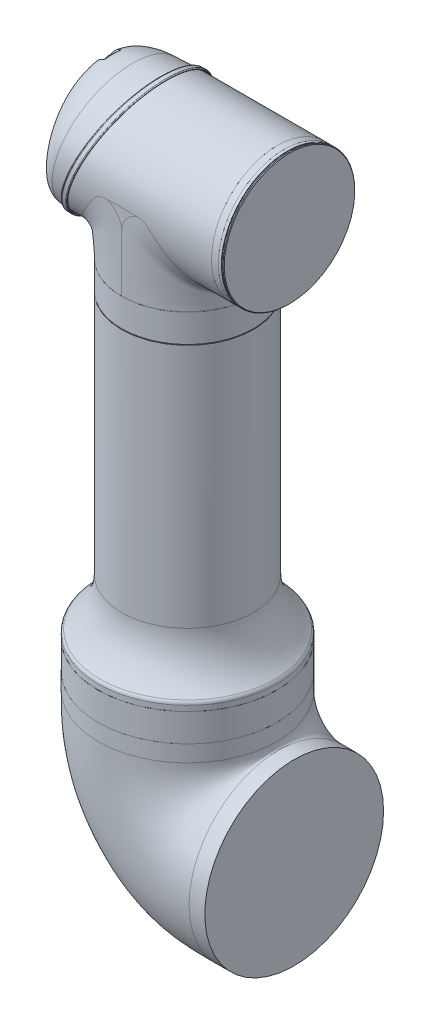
SolidWorks part; units mm, degrees
ref_plane "前视基准面" through (0, 0, 0) normal (0, 0, 1) x (1, 0, 0)
ref_plane "上视基准面" through (0, 0, 0) normal (0, 1, 0) x (1, 0, 0)
ref_plane "右视基准面" through (0, 0, 0) normal (1, 0, 0) x (0, 0, -1)
imported_body "CS612-Link2A-1-solid1"
imported_body "CS612-Link2B-1-solid1"
imported_body "CS612-Link2B-1-solid2"
imported_body "CS612-Link2B-1-solid3"
imported_body "CS612-J6-1-solid1"
imported_body "CS612-J6-1-solid2"
imported_body "CS612-J6-1-solid3"
imported_body "CS612-J6-1-solid4"
imported_body "CS612-J6-1-solid5"
imported_body "CS612-J6-1-solid6"
imported_body "CS612-J6-1-solid7"
imported_body "CS612-J6-1-solid8"
imported_body "CS612-J6-1-solid9"
imported_body "CS612-J6-1-solid10"
ref_plane "基准面1" through (0, 250, 0) normal (0, 1, 0) x (1, 0, 0)
split "分割1" trim tools "基准面1" bodies to split 109 resulting bodies 120 121
other "移动面1" parameters "D1"=210
move or copy body "实体-移动/复制1" bodies to move or copy 106 121 107 copy no translate (0, 210, 0)
combine bodies "组合1" operation type add bodies to combine 124 122
